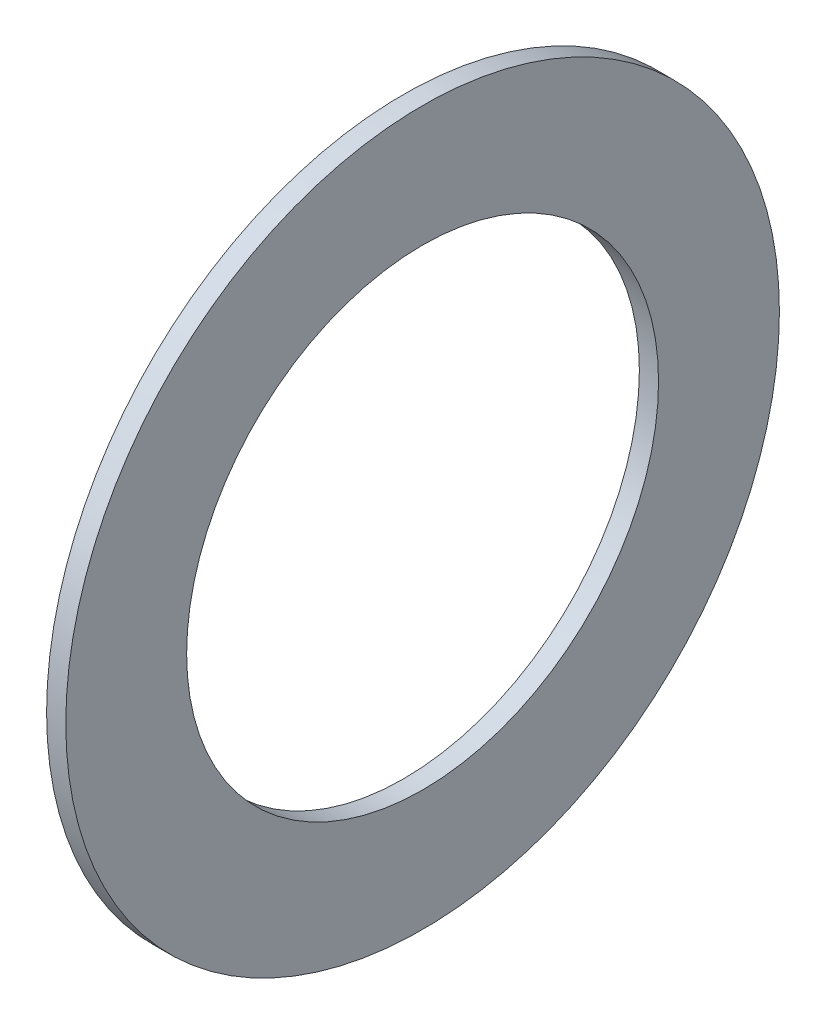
SolidWorks part; units mm, degrees
ref_plane "Face" through (0, 0, 0) normal (0, 0, 1) x (1, 0, 0)
ref_plane "Dessus" through (0, 0, 0) normal (0, 1, 0) x (1, 0, 0)
ref_plane "Droite" through (0, 0, 0) normal (1, 0, 0) x (0, 0, -1)
sketch "Esquisse1" plane through (0, 0, 0) normal (0, 0, 1) x (1, 0, 0)
  line L0 (-10.6251, 0) -> (16.1344, 0) construction
  line L2 (-1, 18.6) -> (0, 18.6)
  line L3 (-1, 18.6) -> (-1, 12.3)
  line L4 (-1, 12.3) -> (0, 12.3)
  line L5 (0, 18.6) -> (0, 12.3)
  dimension "D1" = 24.6
  dimension "D2" = 37.2
  dimension "D3" = 1
revolve "Base-Révolution" add sketch "Esquisse1" angle 360 about L0
sketch "Esquisse2" plane through (0, 0, 0) normal (1, 0, 0) x (0, 0, -1)
  line L0 (0, 18.6) -> (0, -18.6)
  circle A0 centre (0, 0) radius 18.6 construction
  arc A1 (0, 18.6) -> (0, -18.6) centre (0, 0) ccw
extrude "COUPE" [suppressed] cut sketch "Esquisse2" against normal up to next
